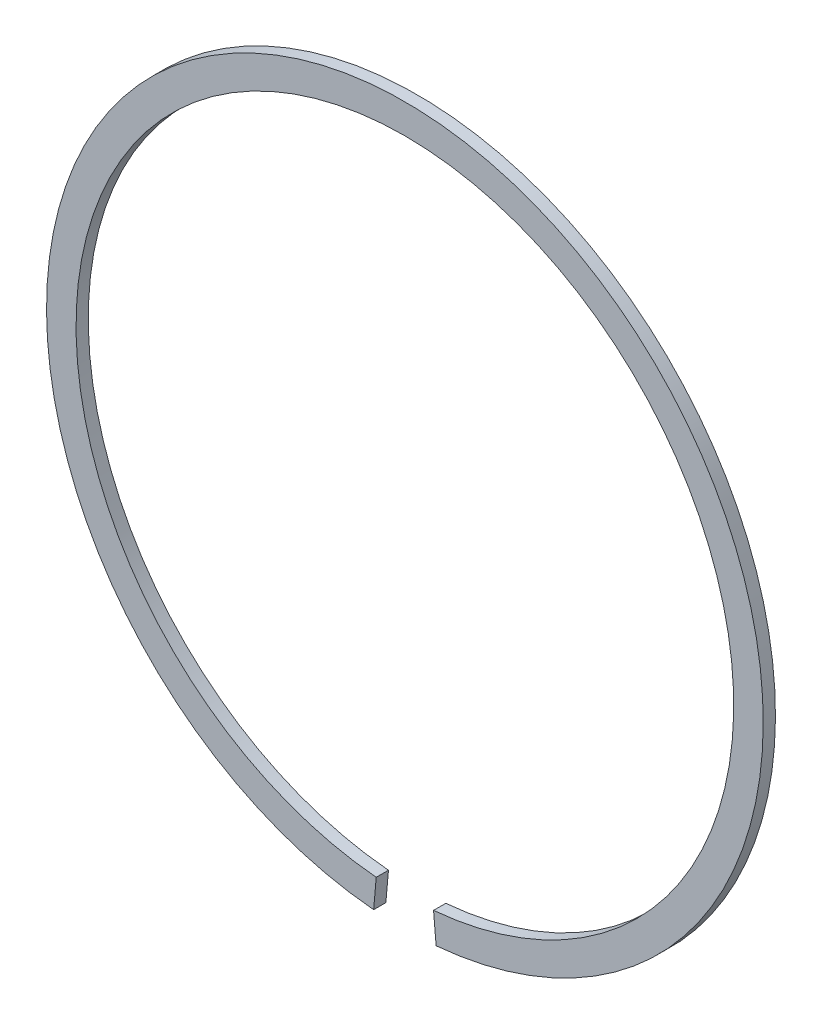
SolidWorks part; units mm, degrees
ref_plane "Front X-Y" through (0, 0, 0) normal (0, 0, 1) x (1, 0, 0)
ref_plane "Top X-Z" through (0, 0, 0) normal (0, 1, 0) x (1, 0, 0)
ref_plane "Right Y-Z" through (0, 0, 0) normal (1, 0, 0) x (0, 0, -1)
ref_plane "Plane1" through (0, 0, 0) normal (0, 0, 1) x (1, 0, 0)
sketch "Sketch1" plane through (0, 0, 0) normal (0, 0, 1) x (1, 0, 0)
  line L0 (-2.1702, -24.8052) -> (-1.9915, -22.763)
  line L1 (1.9915, -22.763) -> (2.1702, -24.8052)
  arc A0 (2.1702, -24.8052) -> (-2.1702, -24.8052) centre (0, 0) ccw
  arc A1 (-1.9915, -22.763) -> (1.9915, -22.763) centre (0, 0) cw
extrude "Boss-Extrude1" add sketch "Sketch1" along normal blind 0.85
